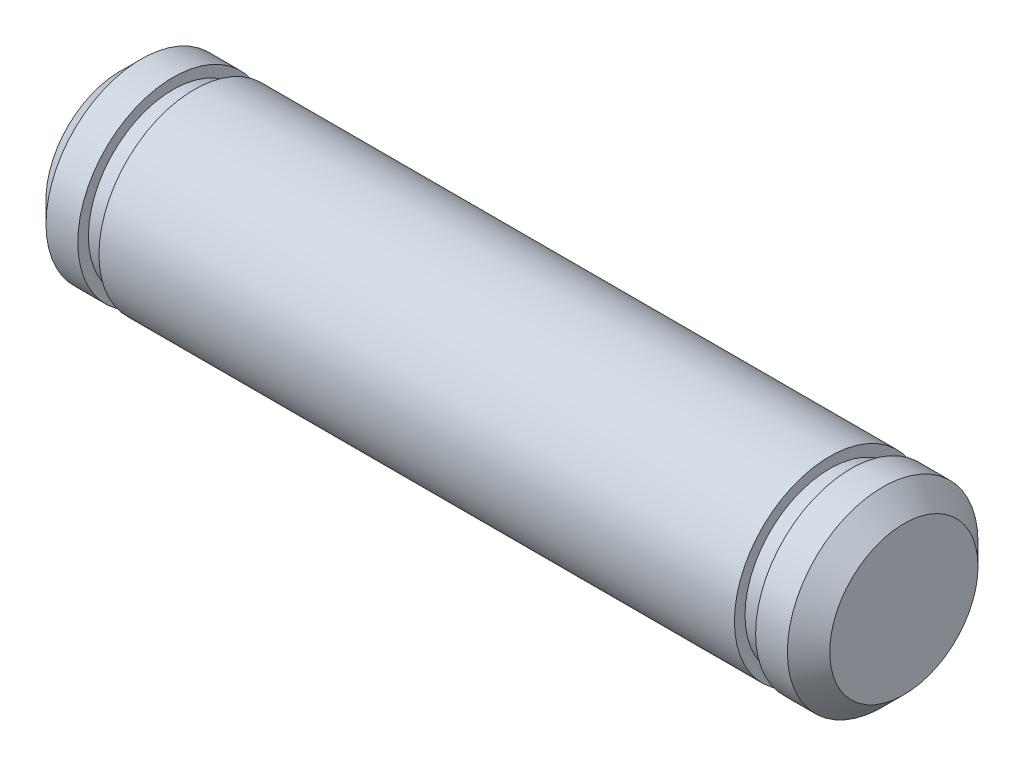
SolidWorks part; units mm, degrees
ref_plane "Plan1" through (0, 0, 0) normal (0, 0, 1) x (1, 0, 0)
ref_plane "Plan2" through (0, 0, 0) normal (0, 1, 0) x (1, 0, 0)
ref_plane "Plan3" through (0, 0, 0) normal (1, 0, 0) x (0, 0, -1)
sketch "Esquisse1" plane through (0, 0, 0) normal (0, 0, 1) x (1, 0, 0)
  line L0 (-89.6948, 20) -> (-87.1948, 20)
  line L1 (-89.6948, 15.5) -> (-60, 15.5) construction
  line L2 (-87.1948, 20) -> (-87.1948, 19.5)
  line L3 (-87.1948, 19.5) -> (-86.1948, 19.5)
  line L4 (-86.1948, 19.5) -> (-86.1948, 20)
  line L5 (-89.6948, 20) -> (-89.6948, 15.5)
  line L6 (-71.1948, 20) -> (-71.1948, 6.3054) construction
  line L7 (-86.1948, 20) -> (-56.1948, 20)
  line L8 (-52.6948, 20) -> (-52.6948, 15.5)
  line L9 (-56.1948, 19.5) -> (-56.1948, 20)
  line L10 (-55.1948, 19.5) -> (-56.1948, 19.5)
  line L11 (-55.1948, 20) -> (-55.1948, 19.5)
  line L12 (-52.6948, 20) -> (-55.1948, 20)
  line L13 (-89.6948, 15.5) -> (-52.6948, 15.5)
  point P10 (-71.1948, 20)
  dimension "D1" = 18.5
  dimension "D2" = 4.5
  dimension "D3" = 2.5
  dimension "D4" = 4
  dimension "D5" = 1
revolve "Base-Révolution" add sketch "Esquisse1" angle 360 about L1
chamfer "Chanfrein1" distance 1 angle 45
chamfer "Chanfrein2" distance 1 angle 45
